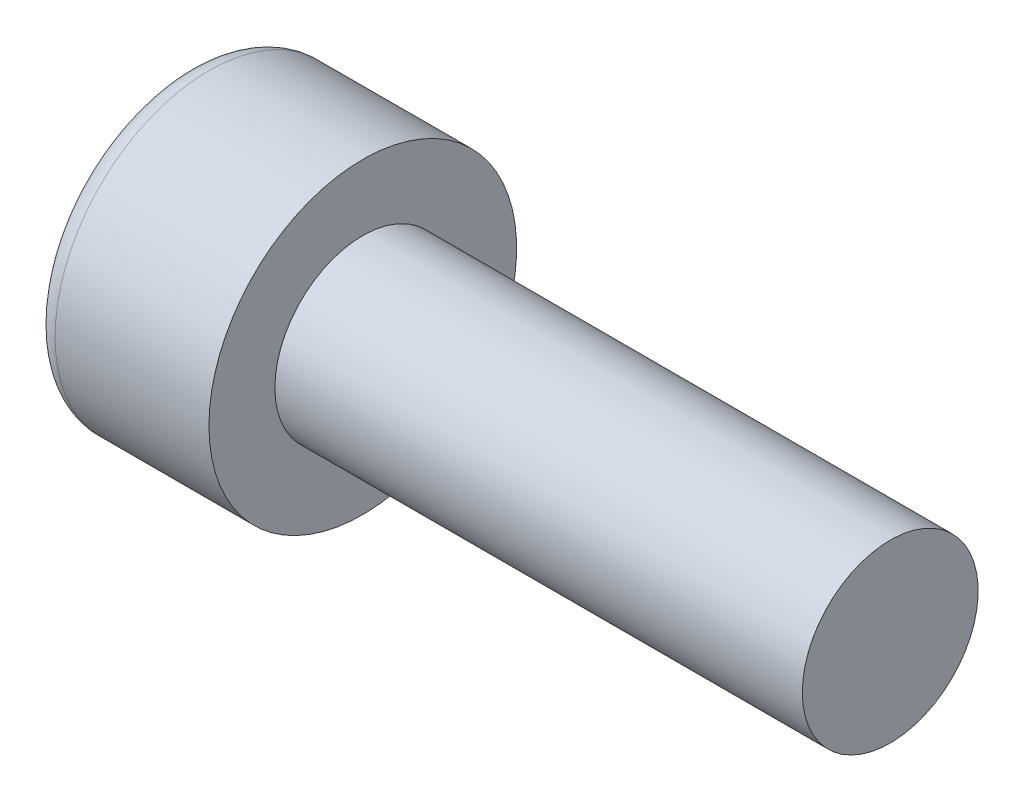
SolidWorks part; units mm, degrees
ref_plane "Ebene vorne" through (0, 0, 0) normal (0, 0, 1) x (1, 0, 0)
ref_plane "Ebene oben" through (0, 0, 0) normal (0, 1, 0) x (1, 0, 0)
ref_plane "Ebene rechts" through (0, 0, 0) normal (1, 0, 0) x (0, 0, -1)
sketch "Skizze1" plane through (0, 0, 0) normal (0, 0, 1) x (1, 0, 0)
  line L0 (-65.0118, 0) -> (64.6036, 0) construction
  line L1 (-16, 0) -> (-16, 3.5)
  line L2 (-16, 3.5) -> (-12, 3.5)
  line L3 (-12, 3.5) -> (-12, 2)
  line L4 (-12, 2) -> (0, 2)
  line L5 (0, 2) -> (0, 0)
  line L6 (0, 0) -> (-16, 0)
  dimension "D1" = 4
  dimension "D2" = 12
  dimension "D3" = 7
  dimension "D4" = 4
revolve "Rotation1" add sketch "Skizze1" angle 360 about L0
fillet "Verrundung1" radius 0.5
sketch "Skizze2" plane through (-16, 0, 0) normal (-1, 0, 0) x (0, 0, 1)
  line L1 (1.5, 0.866) -> (0, 1.7321)
  line L2 (0, 1.7321) -> (-1.5, 0.866)
  line L3 (-1.5, 0.866) -> (-1.5, -0.866)
  line L4 (-1.5, -0.866) -> (0, -1.7321)
  line L5 (0, -1.7321) -> (1.5, -0.866)
  line L6 (1.5, -0.866) -> (1.5, 0.866)
  circle A0 centre (0, 0) radius 1.5 construction
  dimension "D1" = 3
extrude "Schnitt-Linear austragen1" cut sketch "Skizze2" against normal blind 3
